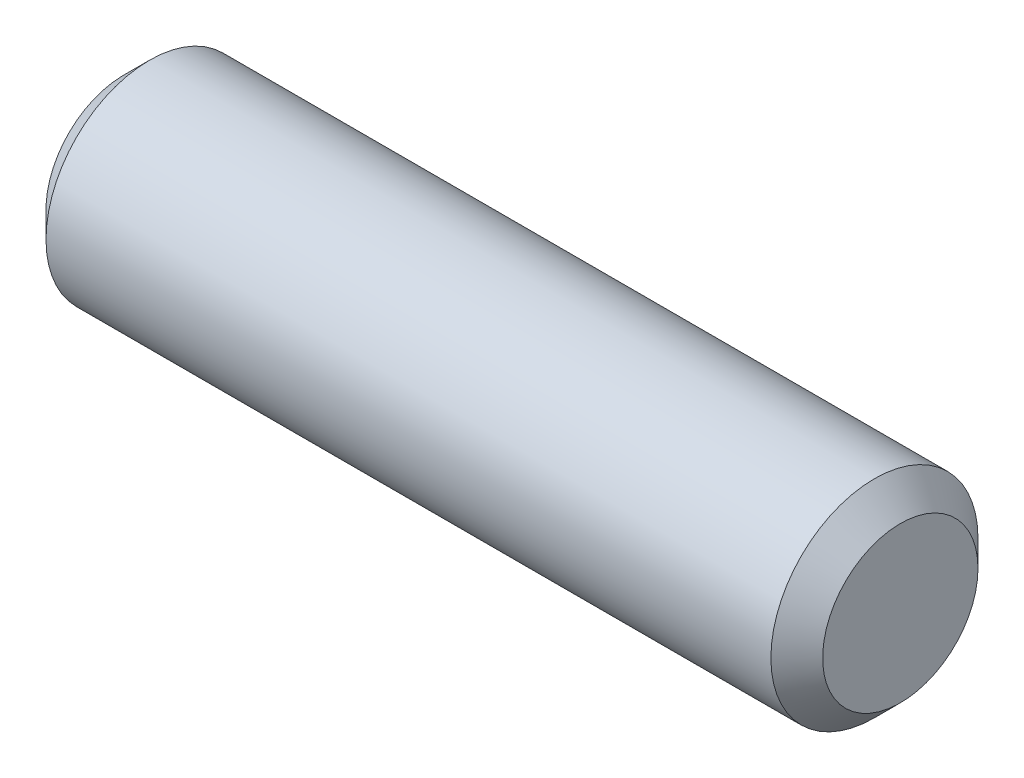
SolidWorks part; units mm, degrees
ref_plane "前视基准面" through (0, 0, 0) normal (0, 0, 1) x (1, 0, 0)
ref_plane "上视基准面" through (0, 0, 0) normal (0, 1, 0) x (1, 0, 0)
ref_plane "右视基准面" through (0, 0, 0) normal (1, 0, 0) x (0, 0, -1)
sketch "草图1" plane through (0, 0, 0) normal (1, 0, 0) x (0, 0, -1)
  circle A0 centre (0, 0) radius 2
  dimension "D1" = 4
extrude "凸台-拉伸1" add sketch "草图1" along normal blind 15
chamfer "倒角1" distance 0.5 angle 45 2 edges at (0, 0, -2) (15, 0, -2)
